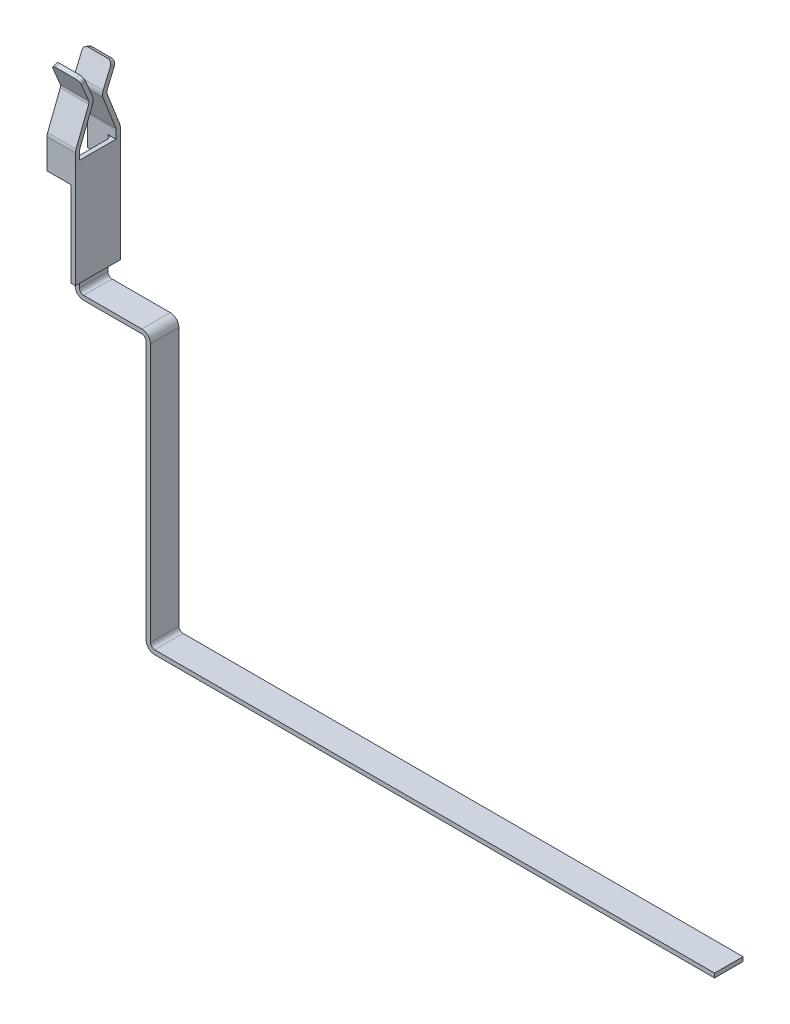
SolidWorks part; units mm, degrees
ref_plane "Front Plane" through (0, 0, 0) normal (0, 0, 1) x (1, 0, 0)
ref_plane "Top Plane" through (0, 0, 0) normal (0, 1, 0) x (1, 0, 0)
ref_plane "Right Plane" through (0, 0, 0) normal (1, 0, 0) x (0, 0, -1)
sketch "Sketch1" plane through (0, 0, 0) normal (0, 0, 1) x (1, 0, 0)
  line L0 (0, 0) -> (0, -6.35)
  line L1 (0, -6.35) -> (6.35, -6.35)
  line L2 (6.35, -6.35) -> (6.35, -107.95)
  dimension "D1" = 6.35
  dimension "D2" = 6.35
  dimension "D3" = 101.6
extrude "Extrude-Thin1" add sketch "Sketch1" along normal mid plane 2.54 thin
fillet "Fillet1" radius 0.381 2 edges at (6.35, -6.35, 0) (0.381, -5.969, 0)
fillet "Fillet2" radius 0.762 2 edges at (6.731, -5.969, 0) (0, -6.35, 0)
sketch "Sketch3" plane through (0, 0, 0) normal (0, 0, 1) x (1, 0, 0)
  line L0 (0.381, 0) -> (0.381, -5.588) construction
  line L1 (0.381, 4.6743) -> (0.381, -4.8507)
  dimension "D1" = 9.525
extrude "Extrude-Thin2" add sketch "Sketch3" along normal mid plane 4.0132 thin
sketch "Sketch4" plane through (0.762, 0, 0) normal (1, 0, 0) x (0, 0, -1)
  line L0 (-2.0066, 2.7693) -> (-2.0066, 5.5633)
  line L1 (-2.0066, 4.6743) -> (-2.0066, -4.8507) construction
  line L2 (-2.0066, 5.5633) -> (-0.7647, 8.7383)
  line L3 (-0.7647, 8.7383) -> (-1.619, 10.7703)
  line L4 (-2.0066, 4.6743) -> (2.0066, 4.6743) construction
  dimension "D1" = 2.794
  dimension "D2" = 1.905
  dimension "D3" = 3.175
  dimension "D4" = 2.032
extrude "Extrude-Thin3" add sketch "Sketch4" against normal blind 2.54 thin
mirror "Mirror1" about plane through (0, 0, 0) normal (0, 0, 1) of "Extrude-Thin3"
fillet "Fillet3" radius 0.381 2 edges at (0.381, 3.7218, -1.6256) (0.381, 3.7218, 1.6256)
fillet "Fillet4" radius 0.381 4 edges at (-0.508, 5.4914, 1.6256) (-0.508, 8.7383, -0.7647) (-0.508, 5.4914, -1.6256) (-0.508, 8.7383, 0.7647)
fillet "Fillet5" radius 0.762 4 edges at (-0.508, 8.7435, 0.3536) (-0.508, 5.5633, 2.0066) (-0.508, 5.5633, -2.0066) (-0.508, 8.7435, -0.3536)
fillet "Fillet6" radius 0.381 4 edges at (0.762, 10.8441, 1.4433) (-1.778, 10.8441, 1.4433) (0.762, 10.8441, -1.4433) (-1.778, 10.8441, -1.4433)
sketch "Sketch5" plane through (0, 0, 1.27) normal (0, 0, 1) x (1, 0, 0)
  line L0 (6.35, -6.731) -> (6.35, -107.95) construction
  line L1 (6.35, -30.607) -> (6.731, -30.607)
  line L2 (6.35, -30.607) -> (6.35, -107.95)
  line L3 (6.35, -107.95) -> (6.731, -107.95)
  line L4 (6.731, -30.607) -> (6.731, -107.95)
  line L5 (0.762, -6.35) -> (5.969, -6.35) construction
  dimension "D1" = 24.257
extrude "Cut-Extrude1" cut sketch "Sketch5" against normal through all
sketch "Sketch6" plane through (0, 0, 1.27) normal (0, 0, 1) x (1, 0, 0)
  line L0 (6.35, -30.607) -> (57.15, -30.607)
  dimension "D1" = 50.8
extrude "Extrude-Thin4" add sketch "Sketch6" against normal up to surface (2.54 mm away) thin
fillet "Fillet7" radius 0.381 1 edges at (6.731, -30.226, 0)
fillet "Fillet8" radius 0.762 1 edges at (6.35, -30.607, 0)
